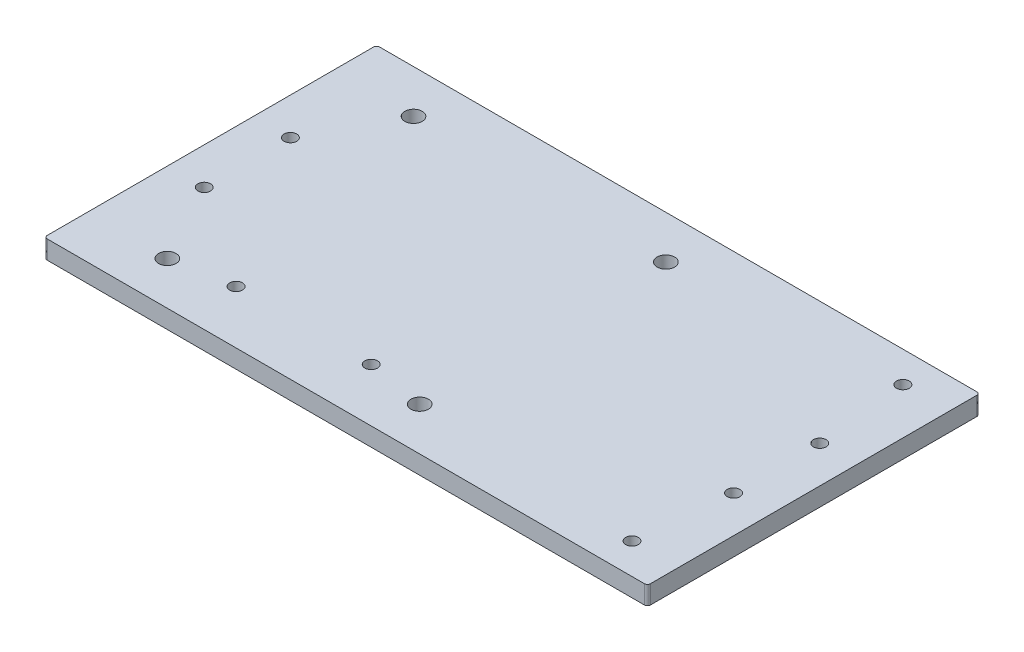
SolidWorks part; units mm, degrees
ref_plane "Front Plane" through (0, 0, 0) normal (0, 0, 1) x (1, 0, 0)
ref_plane "Top Plane" through (0, 0, 0) normal (0, 1, 0) x (1, 0, 0)
ref_plane "Right Plane" through (0, 0, 0) normal (1, 0, 0) x (0, 0, -1)
sketch "Sketch1" plane through (0, 0, 0) normal (0, 1, 0) x (1, 0, 0)
  line L1 (-49, 27) -> (49, 27)
  line L2 (-49, 27) -> (-49, -27)
  line L3 (-49, -27) -> (49, -27)
  line L4 (49, 27) -> (49, -27)
  line L5 (-49, 27) -> (49, -27) construction
  line L6 (-49, -27) -> (49, 27) construction
  point P0 (0, 0)
  dimension "D1" = 54
  dimension "D2" = 98
extrude "Boss-Extrude1" add sketch "Sketch1" along normal blind 3
sketch "Sketch2" plane through (0, 3, 0) normal (0, 1, 0) x (1, 0, 0)
  line L0 (41.5, 27) -> (41.5, -27) construction
  line L1 (49, 27) -> (-49, 27) construction
  line L2 (-49, -27) -> (49, -27) construction
  line L3 (49, -27) -> (49, 27) construction
  line L4 (-49, 0) -> (49, 0) construction
  line L5 (-49, 27) -> (-49, -27) construction
  line L6 (34, 27) -> (34, -27) construction
  line L7 (41.5, 27) -> (41.5, 0) construction
  line L8 (34, 22) -> (49, 22) construction
  circle A0 centre (41.5, 22) radius 1.03
  circle A1 centre (41.5, -22) radius 1.03
  dimension "D3" = 2.06
  dimension "D1" = 7.5
  dimension "D2" = 15
  dimension "D4" = 5
extrude "Cut-Extrude1" cut sketch "Sketch2" against normal blind 3
sketch "Sketch3" plane through (0, 3, 0) normal (0, 1, 0) x (1, 0, 0)
  line L0 (-49, 0) -> (49, 0) construction
  line L1 (-49, 27) -> (-49, -27) construction
  line L2 (49, -27) -> (49, 27) construction
  line L3 (-49, -20) -> (49, -20) construction
  line L4 (-49, -27) -> (49, -27) construction
  circle A0 centre (5, -20) radius 1.42
  circle A1 centre (-36, -20) radius 1.42
  circle A2 centre (5, 20) radius 1.42
  circle A3 centre (-36, 20) radius 1.42
  dimension "D2" = 2.84
  dimension "D4" = 2.84
  dimension "D1" = 7
  dimension "D3" = 44
  dimension "D5" = 85
extrude "Cut-Extrude2" cut sketch "Sketch3" against normal through all
sketch "Sketch4" plane through (0, 3, 0) normal (0, 1, 0) x (1, 0, 0)
  line L0 (-36, -18.35) -> (5, -18.35) construction
  line L1 (-15.5, -27) -> (-15.5, 27) construction
  line L2 (-49, -27) -> (49, -27) construction
  line L3 (49, 27) -> (-49, 27) construction
  line L4 (5, -27) -> (5, -6.1242) construction
  line L5 (-36, -27) -> (-36, -6.1242) construction
  circle A0 centre (-4.525, -18.35) radius 1.03
  circle A1 centre (-26.475, -18.35) radius 1.03
  dimension "D2" = 2.06
  dimension "D1" = 8.65
  dimension "D3" = 21.95
extrude "Cut-Extrude3" cut sketch "Sketch4" against normal through all
sketch "Sketch5" plane through (0, 3, 0) normal (0, 1, 0) x (1, 0, 0)
  line L2 (-49, 0) -> (49, 0) construction
  line L4 (-49, 27) -> (-49, -27) construction
  line L6 (49, -27) -> (49, 27) construction
  circle A0 centre (-43, 7) radius 1.03
  circle A2 centre (43, 7) radius 1.03
  circle A3 centre (43, -7) radius 1.03
  circle A4 centre (-43, -7) radius 1.03
  dimension "D1" = 2.06
  dimension "D2" = 6
  dimension "D3" = 2.06
  dimension "D5" = 7
  dimension "D4" = 6
  dimension "D6" = 7
extrude "Cut-Extrude5" cut sketch "Sketch5" against normal blind 10
ref_plane "Plane3" through (-49, 3, 27) normal (0, 0, 1) x (1, 0, 0)
fillet "Fillet1" radius 0.5 4 edges at (49, 1.5, -27) (49, 1.5, 27) (-49, 1.5, 27) (-49, 1.5, -27)
